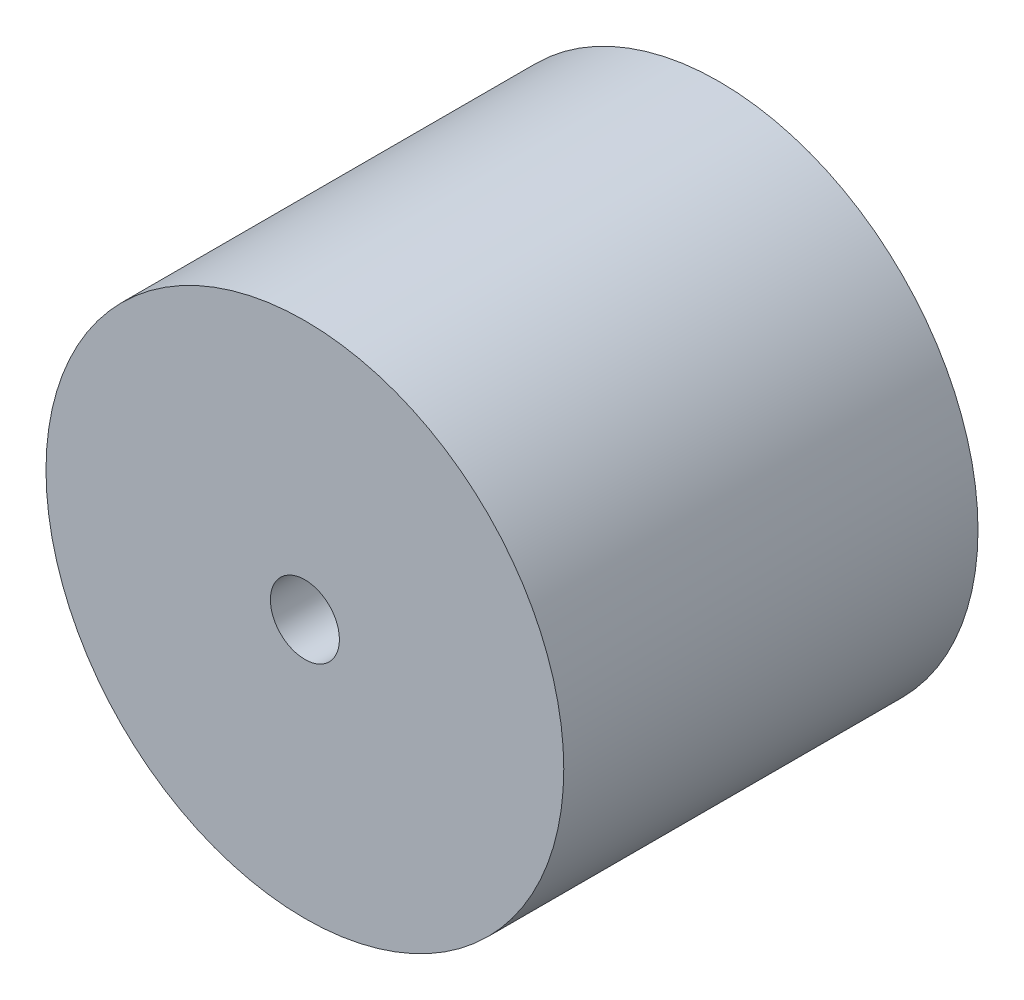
SolidWorks part; units mm, degrees
ref_plane "Plan de face" through (0, 0, 0) normal (0, 0, 1) x (1, 0, 0)
ref_plane "Plan de dessus" through (0, 0, 0) normal (0, 1, 0) x (1, 0, 0)
ref_plane "Plan de droite" through (0, 0, 0) normal (1, 0, 0) x (0, 0, -1)
sketch "Esquisse1" plane through (0, 0, 0) normal (0, 0, 1) x (1, 0, 0)
  circle A0 centre (0, 0) radius 7.5
  circle A1 centre (0, 0) radius 1
  dimension "D1" = 15
extrude "Boss.-Extru.1" add sketch "Esquisse1" along normal blind 12 contours A0 | A1
